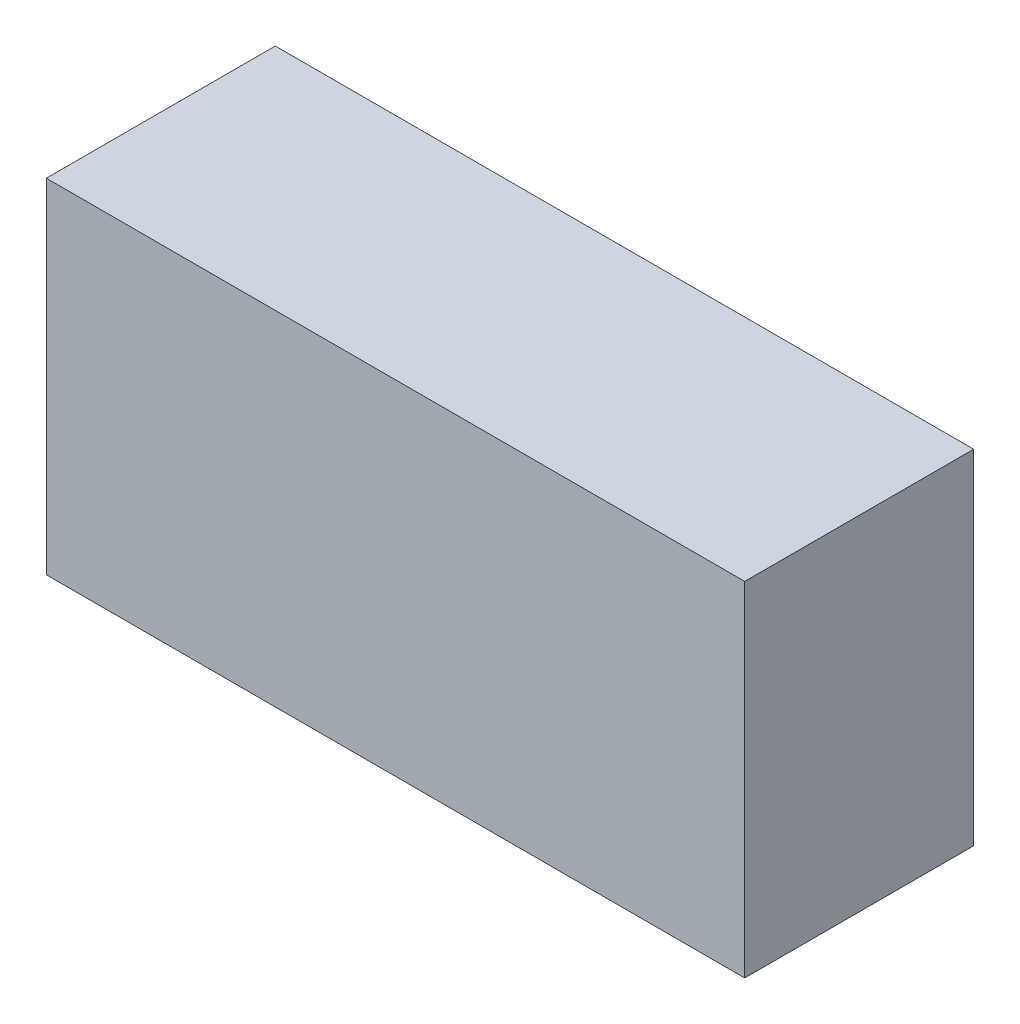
SolidWorks part; units mm, degrees
ref_plane "Front Plane" through (0, 0, 0) normal (0, 0, 1) x (1, 0, 0)
ref_plane "Top Plane" through (0, 0, 0) normal (0, 1, 0) x (1, 0, 0)
ref_plane "Right Plane" through (0, 0, 0) normal (1, 0, 0) x (0, 0, -1)
sketch "GENERAL" plane through (0, 0, 0) normal (0, 0, 1) x (1, 0, 0)
  line L8 (-1.525, -0.75) -> (1.525, -0.75)
  line L9 (1.525, -0.75) -> (1.525, 0.75)
  line L10 (1.525, 0.75) -> (-1.525, 0.75)
  line L11 (-1.525, 0.75) -> (-1.525, -0.75)
extrude "Boss-Extrude1" add sketch "GENERAL" along normal blind 1
